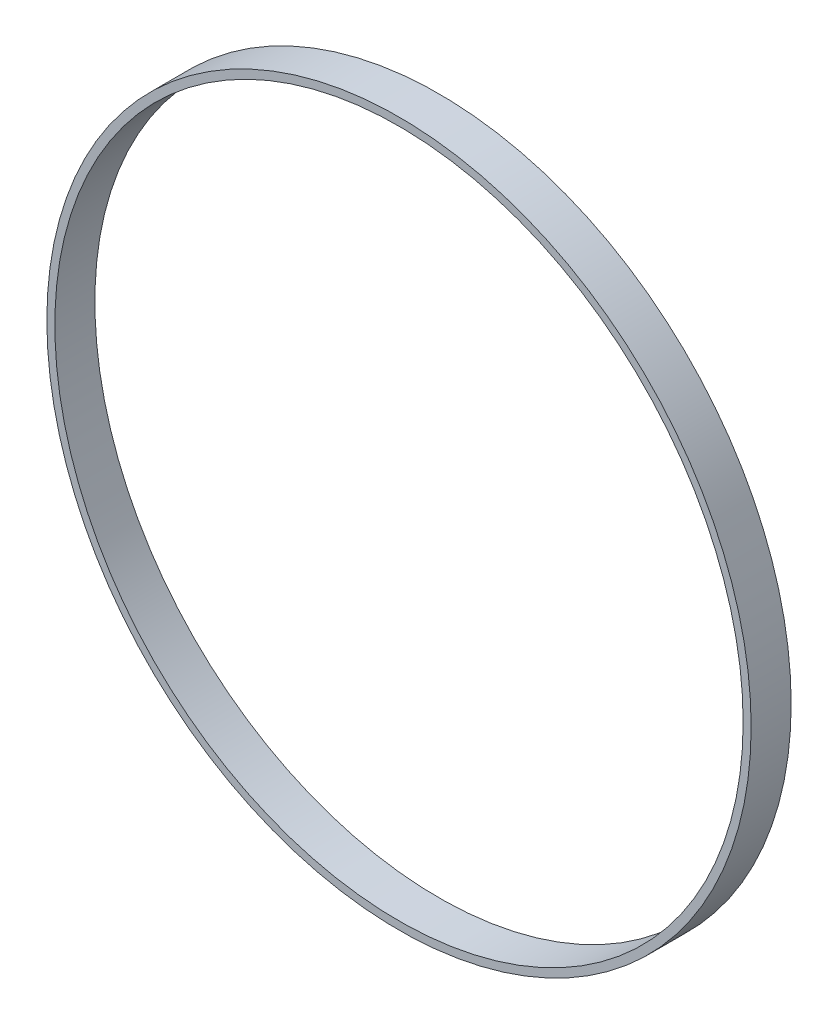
SolidWorks part; units mm, degrees
ref_plane "Plan de face" through (0, 0, 0) normal (0, 0, 1) x (1, 0, 0)
ref_plane "Plan de dessus" through (0, 0, 0) normal (0, 1, 0) x (1, 0, 0)
ref_plane "Plan de droite" through (0, 0, 0) normal (1, 0, 0) x (0, 0, -1)
sketch "Esquisse1" plane through (0, 0, 0) normal (0, 0, 1) x (1, 0, 0)
  circle A0 centre (0, 0) radius 43
  circle A1 centre (0, 0) radius 44
  dimension "D1" = 86
  dimension "D2" = 88
extrude "Extrusion1" add sketch "Esquisse1" along normal blind 5
